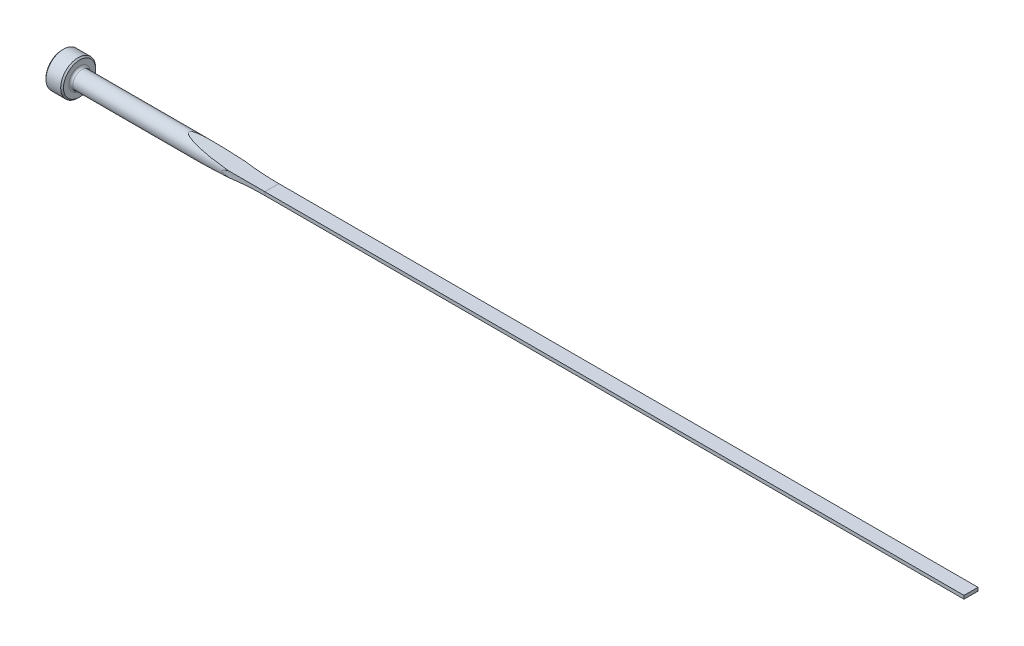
SolidWorks part; units mm, degrees
ref_plane "Front Plane" through (0, 0, 0) normal (0, 0, 1) x (1, 0, 0)
ref_plane "Top Plane" through (0, 0, 0) normal (0, 1, 0) x (1, 0, 0)
ref_plane "Right Plane" through (0, 0, 0) normal (1, 0, 0) x (0, 0, -1)
sketch "Sketch1" plane through (0, 0, 0) normal (0, 0, 1) x (1, 0, 0)
  line L0 (0, 0) -> (167.7268, 0) construction
  line L1 (0, 0) -> (0, 3.175)
  line L2 (0, 3.175) -> (3.175, 3.175)
  line L3 (3.175, 3.175) -> (3.175, 1.5875)
  line L4 (3.175, 1.5875) -> (165.1, 1.5875)
  line L5 (165.1, 1.5875) -> (165.1, 0)
  line L6 (165.1, 0) -> (0, 0)
  dimension "D1" = 165.1
  dimension "D2" = 6.35
  dimension "D3" = 3.175
  dimension "D4" = 3.175
revolve "Revolve1" add sketch "Sketch1" angle 360 about L0
sketch "Sketch2" plane through (0, 0, 0) normal (0, 0, 1) x (1, 0, 0)
  line L0 (165.1, 1.5875) -> (165.1, 0.3048)
  line L1 (165.1, -1.5875) -> (165.1, 1.5875) construction
  line L2 (165.1, 0.3048) -> (38.1, 0.3048)
  line L3 (165.1, 1.5875) -> (3.175, 1.5875) construction
  line L4 (23.0528, 1.5875) -> (165.1, 1.5875)
  line L5 (166.0833, 0) -> (153.1705, 0) construction
  arc A0 (38.1, 0.3048) -> (23.0528, 1.5875) centre (38.1, 89.2048) cw
  dimension "D1" = 88.9
  dimension "D3" = 127
  dimension "D2" = 0.6096
  dimension "D4" = 15.0472
extrude "Cut-Extrude1" cut sketch "Sketch2" against normal through all both and the other way through all
mirror "Mirror1" about plane through (0, 0, 0) normal (0, 1, 0) of "Cut-Extrude1"
sketch "Sketch3" plane through (0, 0, 0) normal (0, 1, 0) x (1, 0, 0)
  line L0 (165.1, 1.5875) -> (165.1, 1.27)
  line L1 (165.1, 1.558) -> (165.1, -1.558) construction
  line L2 (165.1, 1.27) -> (38.1, 1.27)
  line L3 (165.1, 1.5875) -> (3.175, 1.5875) construction
  line L4 (30.5933, 1.5875) -> (165.1, 1.5875)
  line L5 (163.4716, 0) -> (166.2513, 0) construction
  line L6 (38.1, 1.558) -> (38.1, -1.558) construction
  arc A0 (38.1, 1.27) -> (30.5933, 1.5875) centre (38.1, 90.17) cw
  dimension "D2" = 88.9
  dimension "D1" = 2.54
extrude "Cut-Extrude2" cut sketch "Sketch3" against normal through all both and the other way through all
mirror "Mirror2" about plane through (0, 0, 0) normal (0, 0, 1) of "Cut-Extrude2"
fillet "Fillet1" radius 0.381 1 edges at (3.175, 0, 1.5875)
chamfer "Chamfer1" distance 0.254 angle 45 2 edges at (0, 0, 3.175) (3.175, 0, 3.175)
